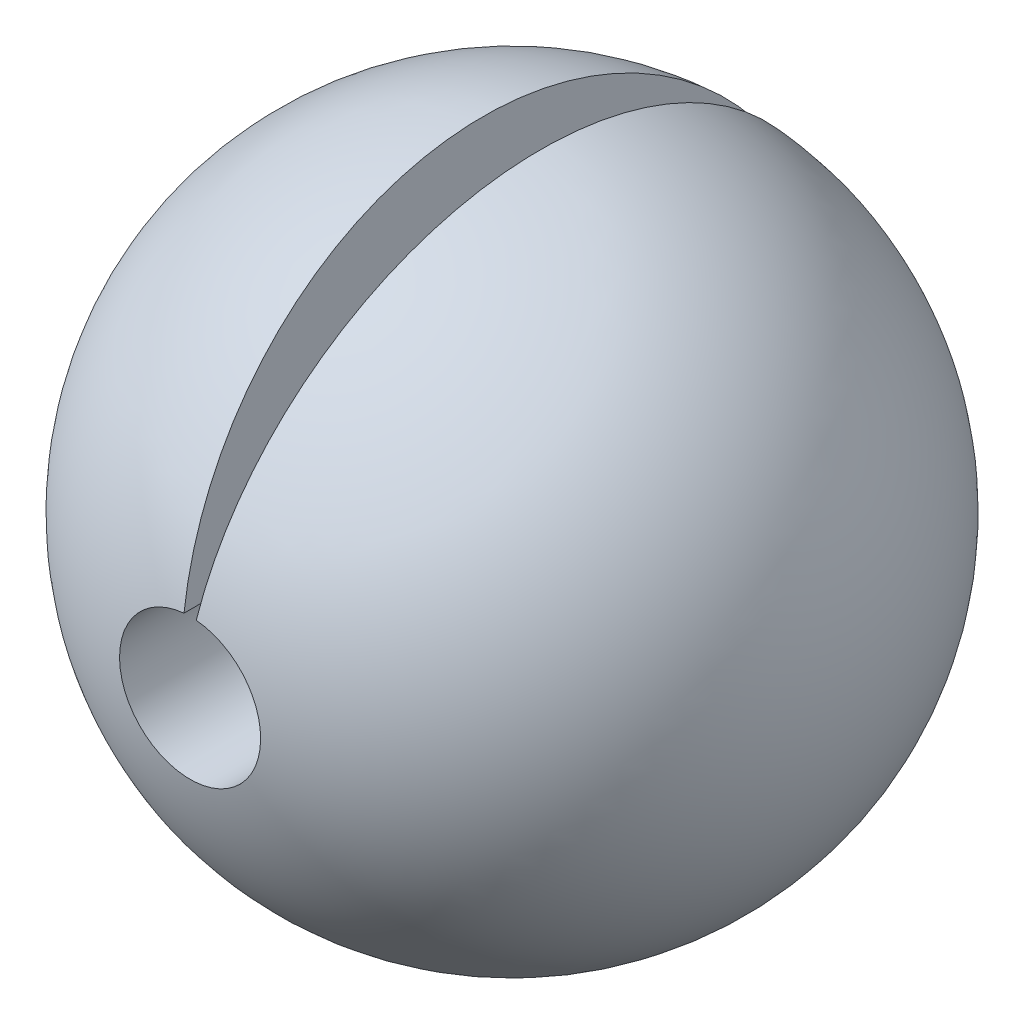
SolidWorks part; units mm, degrees
ref_plane "前视基准面" through (0, 0, 0) normal (0, 0, 1) x (1, 0, 0)
ref_plane "上视基准面" through (0, 0, 0) normal (0, 1, 0) x (1, 0, 0)
ref_plane "右视基准面" through (0, 0, 0) normal (1, 0, 0) x (0, 0, -1)
sketch "草图1" plane through (0, 0, 0) normal (0, 1, 0) x (1, 0, 0)
  line L0 (-202, 922) -> (-202, -922)
  line L1 (0, 0) -> (0, 433.0098) construction
  arc A0 (-202, 922) -> (-202, -922) centre (0, 0) ccw
  dimension "D2" = 1844
  dimension "D3" = 943.8686
  dimension "D1" = 202
revolve "旋转1" add sketch "草图1" angle 360 about L1
sketch "草图2" plane through (0, 0, 0) normal (0, 0, 1) x (1, 0, 0)
  line L0 (0, 0) -> (0, 1015.3849) construction
  line L1 (0, 0) -> (-88.8347, 1015.3849)
  line L2 (-88.8347, 1015.3849) -> (88.8347, 1015.3849)
  line L3 (88.8347, 1015.3849) -> (0, 0)
  dimension "D1" = 5
extrude "切除-拉伸1" cut sketch "草图2" against normal through all both and the other way through all
